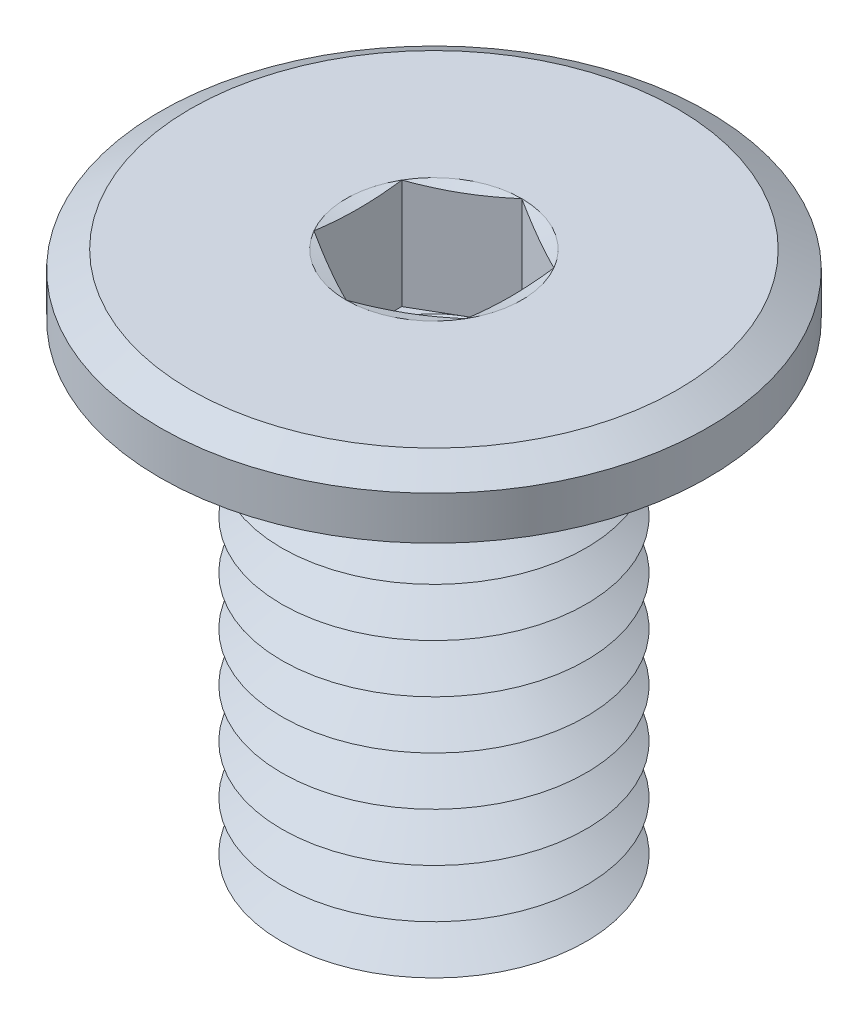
SolidWorks part; units mm, degrees
ref_plane "Front Plane" through (0, 0, 0) normal (0, 0, 1) x (1, 0, 0)
ref_plane "Top Plane" through (0, 0, 0) normal (0, 1, 0) x (1, 0, 0)
ref_plane "Right Plane" through (0, 0, 0) normal (1, 0, 0) x (0, 0, -1)
sketch "Sketch1" plane through (0, 0, 0) normal (0, 1, 0) x (1, 0, 0)
  circle A0 centre (0, 0) radius 4.5
  dimension "D1" = 9
extrude "Boss-Extrude1" add sketch "Sketch1" against normal blind 1
sketch "Sketch2" plane through (0, -1, 0) normal (0, -1, 0) x (1, 0, 0)
  circle A0 centre (0, 0) radius 2.5
  dimension "D1" = 5
extrude "Boss-Extrude2" add sketch "Sketch2" along normal blind 8
sketch "Sketch3" plane through (0, 0, 0) normal (1, 0, 0) x (0, 0, -1)
  line L0 (0, 0.9906) -> (0, -8.2999) construction
sketch "Sketch5" plane through (0, 0, 0) normal (1, 0, 0) x (0, 0, -1)
  line L0 (-2.5, -9.4) -> (-1.8072, -9)
  line L1 (-2.5, -1) -> (-2.5, -9) construction
  line L2 (-1.8072, -9) -> (-2.5, -8.6)
  line L3 (-2.5, -1) -> (-2.5, -9) construction
  line L4 (-2.5, -8.6) -> (-2.5, -9.4)
  line L6 (-2.5, -1) -> (-2.5, -9) construction
  line L7 (-2.5, -1) -> (-2.5, -9) construction
  line L14 (-2.5, -9) -> (2.5, -9) construction
  dimension "D1" = 0.8
revolve "Cut-Revolve1" cut sketch "Sketch5" angle 360 about L0
pattern_linear "LPattern1" count 9 spacing 0.8 along (0, 1, 0) of "Cut-Revolve1"
fillet "Fillet1" radius 0.2 1 edges at (0, -1, -2.5)
chamfer "Chamfer2" distance 0.5 angle 30 1 edges at (0, 0, 4.5)
sketch "Sketch6" plane through (0, 0, 0) normal (0, 1, 0) x (1, 0, 0)
  line L1 (0, 1.4434) -> (-1.25, 0.7217)
  line L2 (-1.25, 0.7217) -> (-1.25, -0.7217)
  line L3 (-1.25, -0.7217) -> (0, -1.4434)
  line L4 (0, -1.4434) -> (1.25, -0.7217)
  line L5 (1.25, -0.7217) -> (1.25, 0.7217)
  line L6 (1.25, 0.7217) -> (0, 1.4434)
  circle A0 centre (0, 0) radius 1.25 construction
  dimension "D1" = 2.5
extrude "Cut-Extrude1" cut sketch "Sketch6" against normal blind 1.8
sketch "Sketch7" plane through (0, -1.8, 0) normal (0, 1, 0) x (1, 0, 0)
  line L0 (-1.25, 0.7217) -> (-1.25, -0.7217) construction
  circle A0 centre (0, 0) radius 1.25
extrude "Cut-Extrude2" cut sketch "Sketch7" against normal through all draft 60
sketch "Sketch8" plane through (0, 0, 0) normal (0, 1, 0) x (1, 0, 0)
  circle A0 centre (0, 0) radius 1.4434
extrude "Cut-Extrude3" cut sketch "Sketch8" against normal through all draft 75
